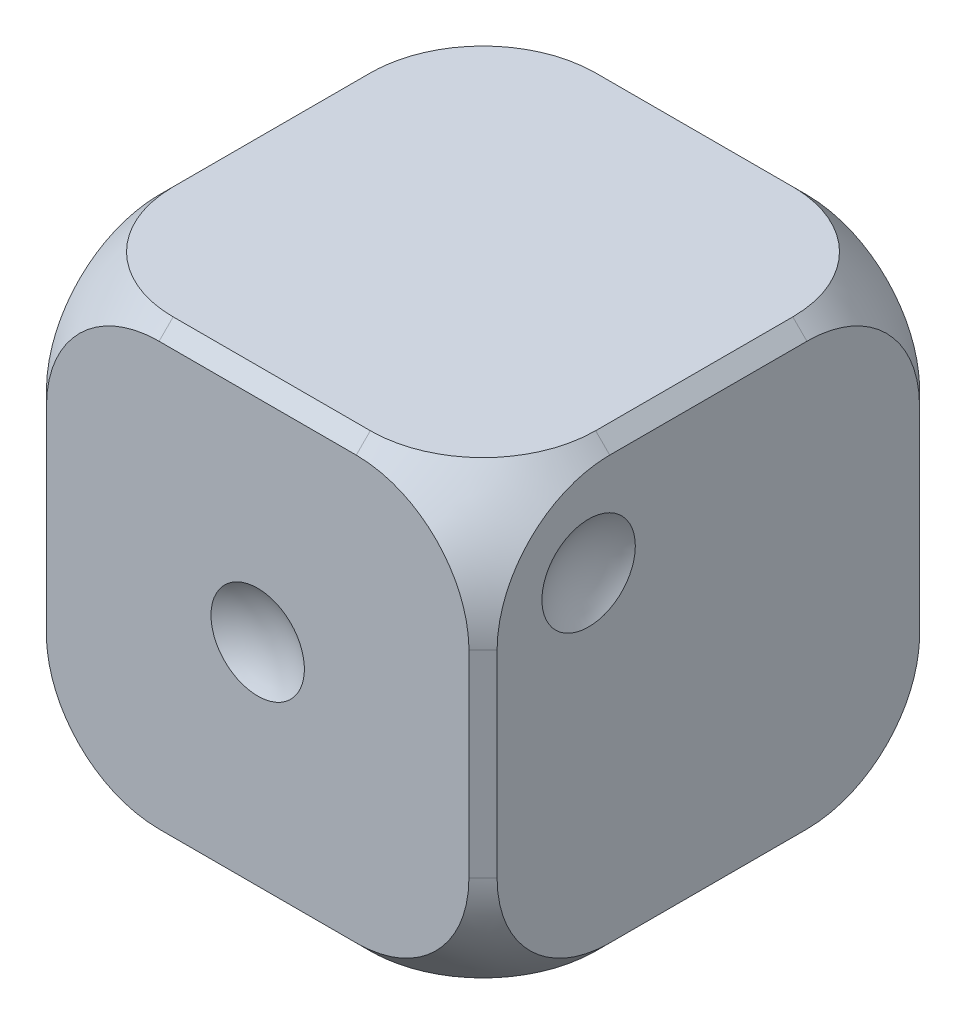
SolidWorks part; units mm, degrees
other "Surface-Knit1" parameters "D1"=5.7108, "D2"=6.771
ref_plane "Front Plane" through (0, 0, 0) normal (0, 0, 1) x (1, 0, 0)
ref_plane "Top Plane" through (0, 0, 0) normal (0, 1, 0) x (1, 0, 0)
ref_plane "Right Plane" through (0, 0, 0) normal (1, 0, 0) x (0, 0, -1)
imported_body "Imported1"
sketch "Sketch2" plane through (0, 0, 8) normal (0, 0, 1) x (1, 0, 0)
  point P0 (-4.25, 4.25)
  dimension "D1" = 4.25
  dimension "D2" = 4.25
ref_plane "Plane1" through (0, 4.25, 0) normal (0, 1, 0) x (1, 0, 0)
sketch "Sketch1" plane through (0, 0, 0) normal (0, 1, 0) x (1, 0, 0)
  line L0 (0, -10.5001) -> (0, 0) construction
  line L2 (-3.5001, -7.5001) -> (3.5001, -7.5001) construction
  line L3 (-2.6636, -10.5001) -> (3.5724, -10.5001) construction
  line L4 (-3, -10.5001) -> (3, -10.5001)
  arc A0 (3, -10.5001) -> (-3, -10.5001) centre (0, -10.5001) ccw
revolve "Dot1" cut sketch "Sketch1" angle 360 about L4
sketch "Sketch5" plane through (0, 4.25, 0) normal (0, 1, 0) x (1, 0, 0)
  line L0 (10.5002, -4.25) -> (4.0422, -4.25) construction
  line L1 (7.5002, -3.5001) -> (7.5001, 3.5001) construction
  line L3 (10.5002, 4.696) -> (10.5002, -5.1835) construction
  line L4 (10.5002, -7.25) -> (10.5002, -1.25)
  arc A0 (10.5002, -1.25) -> (10.5002, -7.25) centre (10.5002, -4.25) ccw
revolve "Dot2" cut sketch "Sketch5" angle 360 about L3
ref_plane "Plane2" through (0, 0, 4.25) normal (0, 0, 1) x (1, 0, 0)
sketch "Sketch9" plane through (0, 0, 4.25) normal (0, 0, 1) x (1, 0, 0)
  line L0 (-4.25, -10.5002) -> (-4.25, -2.9434) construction
  line L2 (3.5001, -7.5002) -> (-3.5001, -7.5002) construction
  line L3 (2.9543, -10.5002) -> (-1.25, -10.5002) construction
  line L4 (-7.25, -10.5002) -> (-1.25, -10.5002)
  arc A0 (-1.25, -10.5002) -> (-7.25, -10.5002) centre (-4.25, -10.5002) ccw
revolve "Dot3" cut sketch "Sketch9" angle 360 about L3
equation "\"Radius\"=3"
equation "\"D1@Sketch1\"=\"Radius\""
equation "\"D1@Sketch5\"=\"Radius\""
equation "\"D1@Sketch9\"=\"Radius\""
